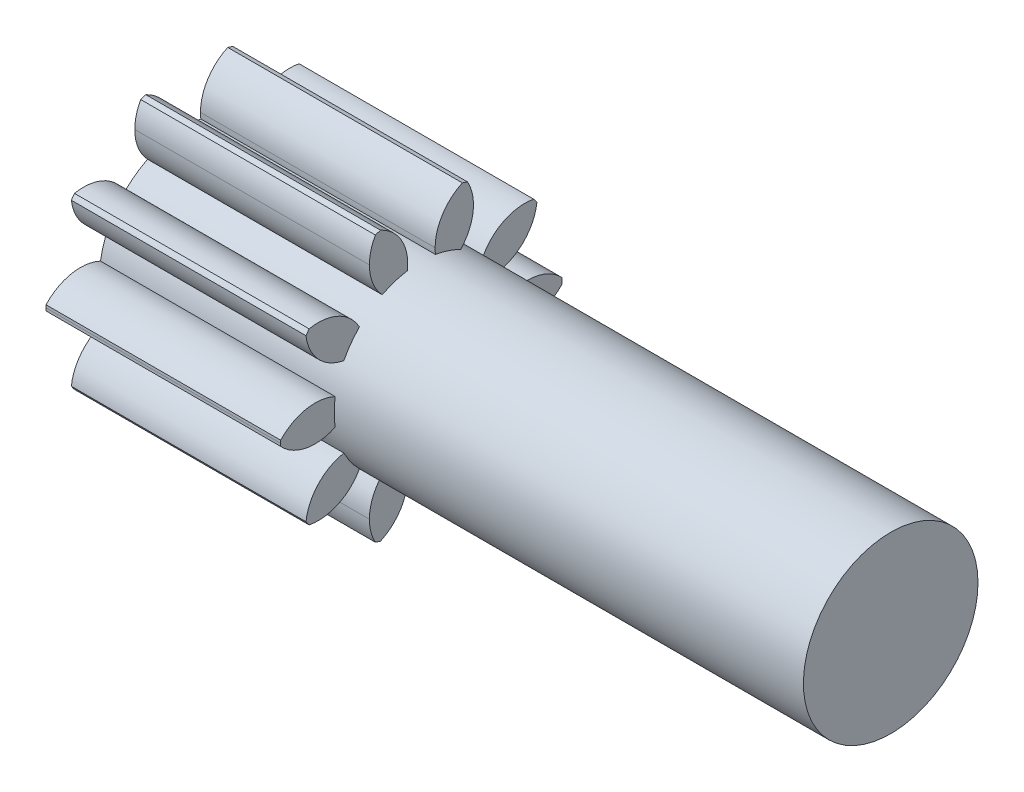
SolidWorks part; units mm, degrees
other "Bore[1]"
ref_plane "Front Plane" through (0, 0, 0) normal (0, 0, 1) x (1, 0, 0)
ref_plane "Top Plane" through (0, 0, 0) normal (0, 1, 0) x (1, 0, 0)
ref_plane "Right Plane" through (0, 0, 0) normal (1, 0, 0) x (0, 0, -1)
imported_body "New Inch - Spur gear 40DP 10T 20PA 0.25FW ---S10N3.0H2.0L0.03125N.STEP<1>"
sketch "Sketch1" plane through (6.35, 0, 0) normal (1, 0, 0) x (0, 0, -1)
  circle A0 centre (0, 0) radius 1.27
  dimension "D1" = 2.54
extrude "Boss-Extrude1" add sketch "Sketch1" against normal up to surface (6.35 mm away)
sketch "Sketch2" plane through (6.35, 0, 0) normal (1, 0, 0) x (0, 0, -1)
  circle A0 centre (0, 0) radius 2.3622
  arc A1 (-2.0997, 1.0822) -> (-2.3348, 0.3587) centre (0, 0) ccw construction
extrude "Boss-Extrude2" add sketch "Sketch2" along normal blind 12.7
